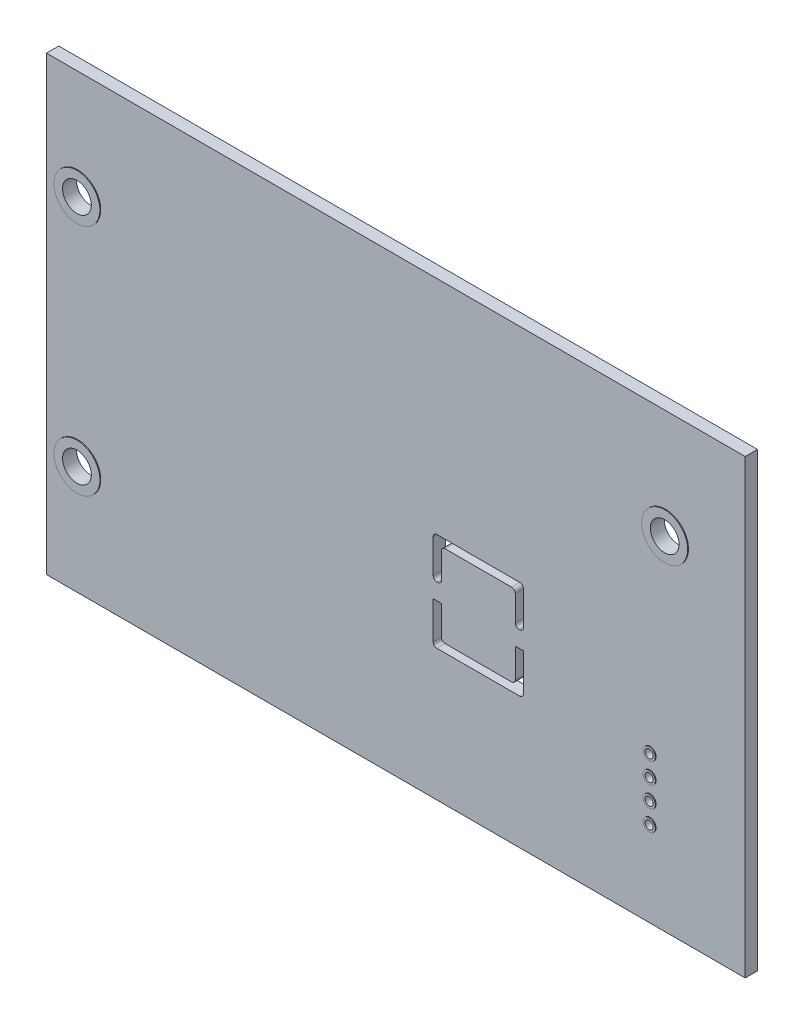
SolidWorks part; units mm, degrees
ref_plane "前视基准面" through (0, 0, 0) normal (0, 0, 1) x (1, 0, 0)
ref_plane "上视基准面" through (0, 0, 0) normal (0, 1, 0) x (1, 0, 0)
ref_plane "右视基准面" through (0, 0, 0) normal (1, 0, 0) x (0, 0, -1)
sketch "草图1" plane through (0, 0, 0) normal (0, 0, 1) x (1, 0, 0)
  line L1 (-42.55, 27.5) -> (42.55, 27.5)
  line L2 (-42.55, 27.5) -> (-42.55, -27.5)
  line L3 (-42.55, -27.5) -> (42.55, -27.5)
  line L4 (42.55, 27.5) -> (42.55, -27.5)
  line L5 (-42.55, 27.5) -> (42.55, -27.5) construction
  line L6 (-42.55, -27.5) -> (42.55, 27.5) construction
  circle A0 centre (-38.74, 14.29) radius 1.75
  circle A1 centre (32.84, 14.29) radius 1.75
  circle A3 centre (-38.74, -14.16) radius 1.75
  circle A4 centre (32.84, -14.16) radius 1.75
  point P0 (0, 0)
  dimension "D3" = 3.5
  dimension "D4" = 3.81
  dimension "D5" = 13.21
  dimension "D8" = 3.81
  dimension "D9" = 13.34
  dimension "D10" = 9.71
  dimension "D11" = 13.21
  dimension "D1" = 55
  dimension "D2" = 85.1
  dimension "D6" = 2
  dimension "D7" = 2
extrude "凸台-拉伸1" add sketch "草图1" along normal blind 1.5
sketch "草图2" plane through (0, 0, 1.5) normal (0, 0, 1) x (1, 0, 0)
  circle A0 centre (-38.74, 14.29) radius 2.8
  circle A1 centre (-38.74, -14.16) radius 2.8
  circle A2 centre (32.84, 14.29) radius 2.8
  circle A3 centre (-38.74, 14.29) radius 1.75
  circle A4 centre (32.84, 14.29) radius 1.75
  circle A5 centre (-38.74, -14.16) radius 1.75
  dimension "D1" = 5.6
  dimension "D2" = 5.6
  dimension "D3" = 5.6
extrude "凸台-拉伸2" add sketch "草图2" along normal blind 0.1 and the other way blind 1.6
sketch "草图3" plane through (0, 0, 0) normal (0, 0, -1) x (-1, 0, 0)
  line L0 (42.55, -27.5) -> (-42.55, -27.5) construction
  line L1 (-42.55, -27.5) -> (-42.55, 27.5) construction
  circle A0 centre (-30.95, -17.1) radius 0.5
  circle A1 centre (-30.95, -14.6) radius 0.5
  circle A2 centre (-30.95, -12.1) radius 0.5
  circle A3 centre (-30.95, -9.6) radius 0.5
  dimension "D1" = 1
  dimension "D2" = 10.4
  dimension "D3" = 11.6
  dimension "D4" = 4
extrude "切除-拉伸1" cut sketch "草图3" against normal through all
sketch "草图4" plane through (0, 0, 0) normal (0, 0, -1) x (-1, 0, 0)
  circle A0 centre (-30.95, -17.1) radius 0.75
  circle A1 centre (-30.95, -14.6) radius 0.75
  circle A2 centre (-30.95, -12.1) radius 0.75
  circle A3 centre (-30.95, -9.6) radius 0.75
  circle A4 centre (-30.95, -17.1) radius 0.5
  circle A5 centre (-30.95, -14.6) radius 0.5
  circle A6 centre (-30.95, -12.1) radius 0.5
  circle A7 centre (-30.95, -9.6) radius 0.5
  dimension "D1" = 1.5
  dimension "D2" = 4
extrude "凸台-拉伸3" add sketch "草图4" along normal blind 0.1 and the other way blind 1.6
sketch "草图5" plane through (0, 0, 0) normal (0, 0, -1) x (-1, 0, 0)
  line L0 (-15.55, -4.05) -> (-15.55, 0.05)
  line L1 (-15.1, 0.5) -> (-5, 0.5)
  line L2 (-4.55, 0.05) -> (-4.55, -4.05)
  line L3 (-5, -4.5) -> (-5.1, -4.5)
  line L4 (-5.55, -4.05) -> (-5.55, -0.95)
  line L5 (-6, -0.5) -> (-14.1, -0.5)
  line L6 (-14.55, -0.95) -> (-14.55, -4.05)
  line L7 (-15, -4.5) -> (-15.1, -4.5)
  line L8 (-42.55, 27.5) -> (42.55, 27.5) construction
  line L9 (-42.55, -27.5) -> (-42.55, 27.5) construction
  line L10 (-21.167, -5.5) -> (-1.0553, -5.5) construction
  line L11 (-14.55, -6.5) -> (-15.55, -6.5)
  line L12 (-14.55, -10.05) -> (-14.55, -6.5)
  line L13 (-6, -10.5) -> (-14.1, -10.5)
  line L14 (-5.55, -6.5) -> (-5.55, -10.05)
  line L15 (-4.55, -6.5) -> (-5.55, -6.5)
  line L16 (-4.55, -11.05) -> (-4.55, -6.5)
  line L17 (-15.1, -11.5) -> (-5, -11.5)
  line L18 (-15.55, -6.5) -> (-15.55, -11.05)
  arc A0 (-4.55, -11.05) -> (-5, -11.5) centre (-5, -11.05) cw
  arc A1 (-6, -10.5) -> (-5.55, -10.05) centre (-6, -10.05) ccw
  arc A2 (-15.1, -11.5) -> (-15.55, -11.05) centre (-15.1, -11.05) cw
  arc A3 (-14.55, -10.05) -> (-14.1, -10.5) centre (-14.1, -10.05) ccw
  arc A4 (-15.55, 0.05) -> (-15.1, 0.5) centre (-15.1, 0.05) cw
  arc A5 (-14.1, -0.5) -> (-14.55, -0.95) centre (-14.1, -0.95) ccw
  arc A6 (-5, 0.5) -> (-4.55, 0.05) centre (-5, 0.05) cw
  arc A7 (-5.55, -0.95) -> (-6, -0.5) centre (-6, -0.95) ccw
  arc A8 (-4.55, -4.05) -> (-5, -4.5) centre (-5, -4.05) cw
  arc A9 (-5.1, -4.5) -> (-5.55, -4.05) centre (-5.1, -4.05) cw
  arc A10 (-14.55, -4.05) -> (-15, -4.5) centre (-15, -4.05) cw
  arc A11 (-15.55, -4.05) -> (-15.1, -4.5) centre (-15.1, -4.05) ccw
  point P24 (-4.55, -11.5)
  point P27 (-5.55, -10.5)
  point P30 (-15.55, -11.5)
  point P33 (-14.55, -10.5)
  point P36 (-15.55, 0.5)
  point P39 (-14.55, -0.5)
  point P42 (-4.55, 0.5)
  point P45 (-5.55, -0.5)
  point P48 (-4.55, -4.5)
  point P51 (-5.55, -4.5)
  point P54 (-14.55, -4.5)
  point P57 (-15.55, -4.5)
  dimension "D10" = 0.45
  dimension "D1" = 1
  dimension "D2" = 1
  dimension "D3" = 1
  dimension "D4" = 5
  dimension "D5" = 5
  dimension "D6" = 11
  dimension "D7" = 27
  dimension "D8" = 27
  dimension "D9" = 1
extrude "切除-拉伸2" cut sketch "草图5" against normal up to next
